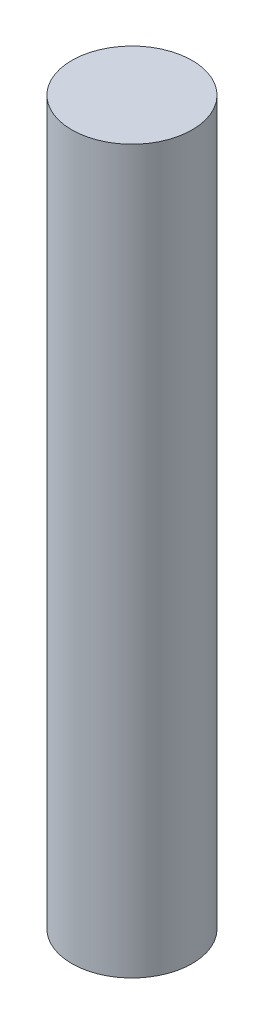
SolidWorks part; units mm, degrees
ref_plane "Alzado" through (0, 0, 0) normal (0, 0, 1) x (1, 0, 0)
ref_plane "Planta" through (0, 0, 0) normal (0, 1, 0) x (1, 0, 0)
ref_plane "Vista lateral" through (0, 0, 0) normal (1, 0, 0) x (0, 0, -1)
sketch "Croquis1" plane through (0, 0, 0) normal (0, 1, 0) x (1, 0, 0)
  circle A0 centre (0, 0) radius 2.5
  dimension "D1" = 5
extrude "Saliente-Extruir1" add sketch "Croquis1" along normal mid plane 30
